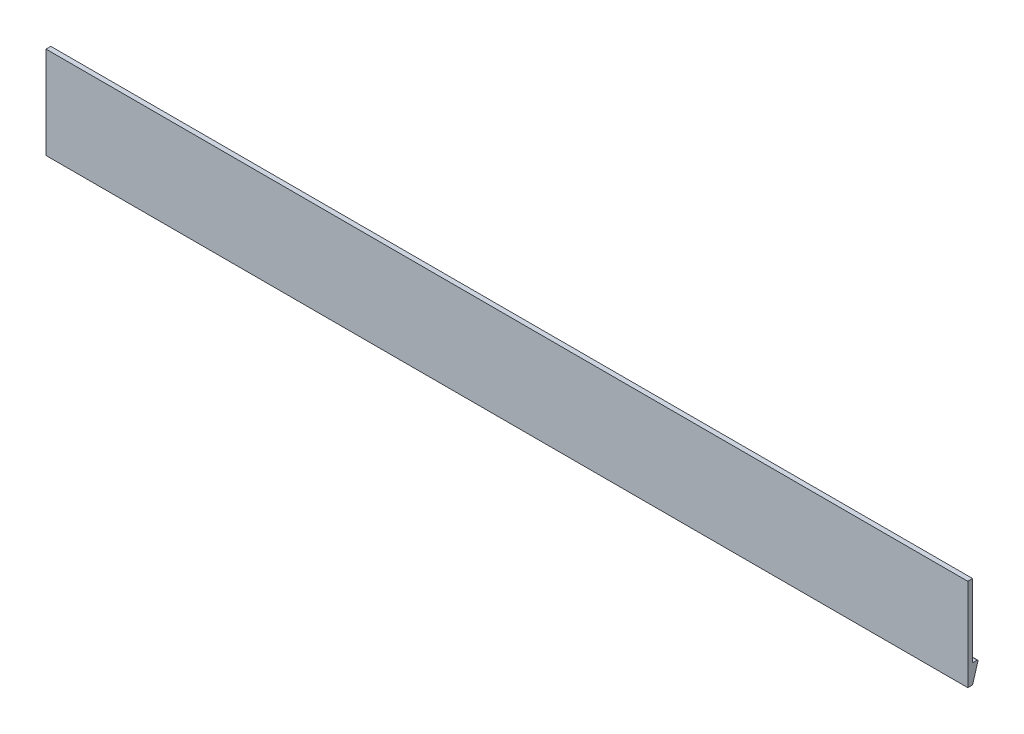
SolidWorks part; units mm, degrees
other "<Water Flap>-<Fillet1>"
ref_plane "Front Plane" through (0, 0, 0) normal (0, 0, 1) x (1, 0, 0)
ref_plane "Top Plane" through (0, 0, 0) normal (0, 1, 0) x (1, 0, 0)
ref_plane "Right Plane" through (0, 0, 0) normal (1, 0, 0) x (0, 0, -1)
mirrored part "Water Flap_Mirrored"
